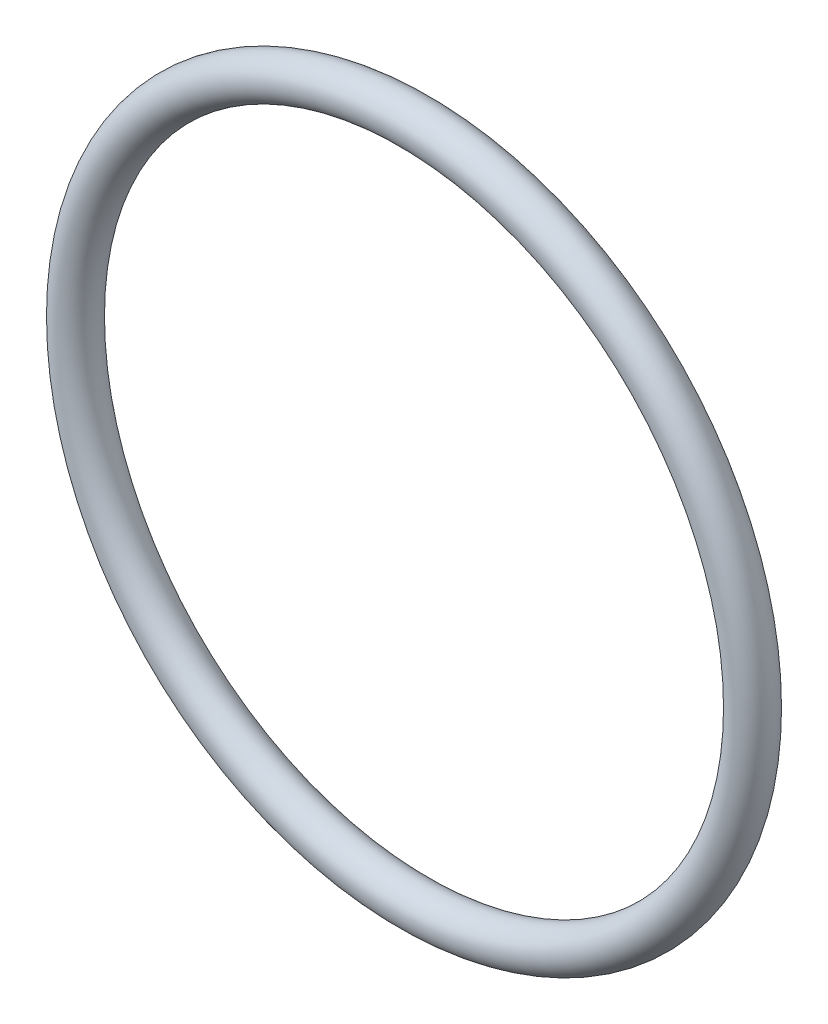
SolidWorks part; units mm, degrees
ref_plane "Front Plane" through (0, 0, 0) normal (0, 0, 1) x (1, 0, 0)
ref_plane "Top Plane" through (0, 0, 0) normal (0, 1, 0) x (1, 0, 0)
ref_plane "Right Plane" through (0, 0, 0) normal (1, 0, 0) x (0, 0, -1)
sketch "Sketch1" plane through (0, 0, 0) normal (1, 0, 0) x (0, 0, -1)
  line L0 (-11.6019, 31.6702) -> (15.5738, 31.6702) construction
  circle A0 centre (1.3588, 48.1702) radius 1
  dimension "D1" = 2
  dimension "D2" = 16.5
revolve "Revolve1" add sketch "Sketch1" angle 360 about L0
